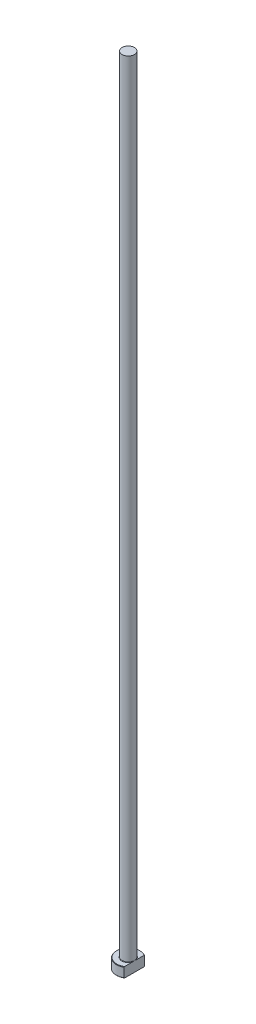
SolidWorks part; units mm, degrees
ref_plane "Front Plane" through (0, 0, 0) normal (0, 0, 1) x (1, 0, 0)
ref_plane "Top Plane" through (0, 0, 0) normal (0, 1, 0) x (1, 0, 0)
ref_plane "Right Plane" through (0, 0, 0) normal (1, 0, 0) x (0, 0, -1)
sketch "Sketch1" plane through (0, 0, 0) normal (0, 0, 1) x (1, 0, 0)
  line L0 (0, 259.9588) -> (0, -15.1925) construction
  line L1 (0, 0) -> (-6, 0)
  line L2 (-6, 0) -> (-6, 5)
  line L3 (-6, 5) -> (-3.1, 5)
  line L4 (-3.1, 5) -> (-3.1, 400)
  line L5 (-3.1, 400) -> (0, 400)
  line L6 (0, 400) -> (0, 0)
  dimension "L" = 400
  dimension "H" = 12
  dimension "T" = 5
  dimension "D" = 6.2
revolve "Revolve1" add sketch "Sketch1" angle 360 about L0
chamfer "Chamfer1" distance 0.2 angle 45 2 edges at (0, 5, 6) (0, 0, 6)
fillet "Fillet1" radius 0.2 1 edges at (0, 5, 3.1)
sketch "Sketch2" plane through (0, 0, 0) normal (0, 1, 0) x (1, 0, 0)
  line L0 (3.1, 5.1371) -> (3.1, -5.1371)
  circle A0 centre (0, 0) radius 6 construction
  arc A1 (3.1, -5.1371) -> (3.1, 5.1371) centre (0, 0) ccw
  circle A2 centre (0, 0) radius 3.1 construction
extrude "KEY" cut sketch "Sketch2" along normal through all
